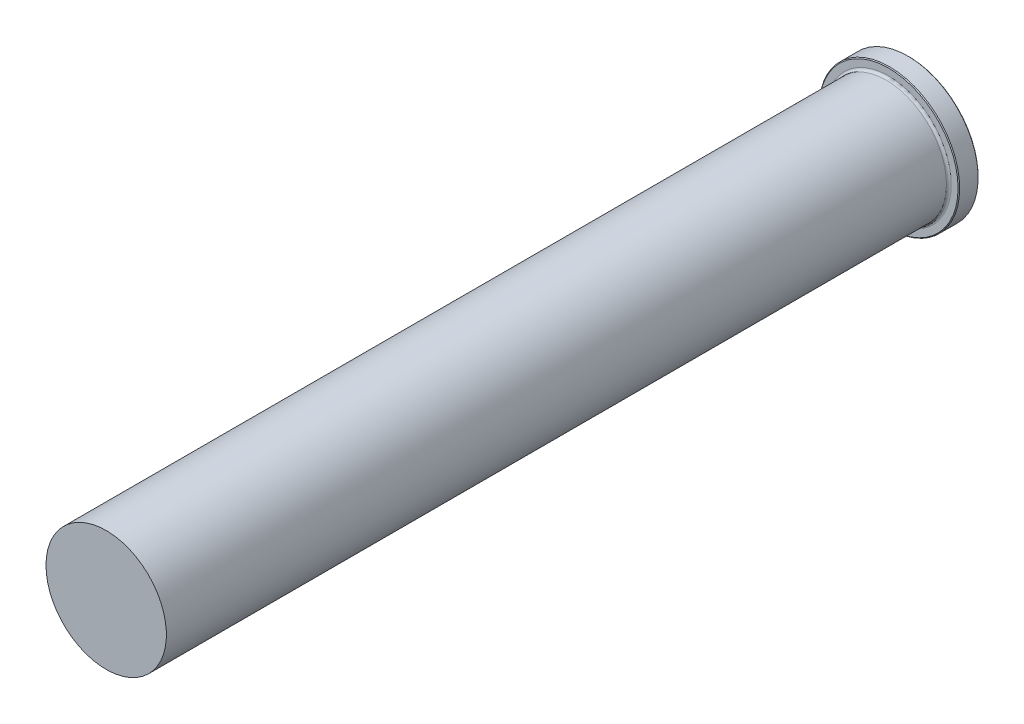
SolidWorks part; units mm, degrees
ref_plane "Front Plane" through (0, 0, 0) normal (0, 0, 1) x (1, 0, 0)
ref_plane "Top Plane" through (0, 0, 0) normal (0, 1, 0) x (1, 0, 0)
ref_plane "Right Plane" through (0, 0, 0) normal (1, 0, 0) x (0, 0, -1)
sketch "Sketch1" plane through (0, 0, 0) normal (1, 0, 0) x (0, 0, -1)
  line L0 (0, 0) -> (-156.8087, 0) construction
  line L1 (0, 0) -> (0, 22.225)
  line L2 (0, 22.225) -> (-6.35, 22.225)
  line L3 (-6.35, 22.225) -> (-6.35, 19.05)
  line L4 (-6.35, 19.05) -> (-254, 19.05)
  line L5 (-254, 19.05) -> (-254, 0)
  line L6 (-254, 0) -> (0, 0)
  dimension "D1" = 44.45
  dimension "D2" = 38.1
  dimension "D3" = 6.35
  dimension "D4" = 254
revolve "Revolve1" add sketch "Sketch1" angle 360 about L0
fillet "Fillet1" radius 0.762 1 edges at (-19.05, 0, 6.35)
chamfer "Chamfer1" distance 0.254 angle 45 2 edges at (-22.225, 0, 0) (-22.225, 0, 6.35)
